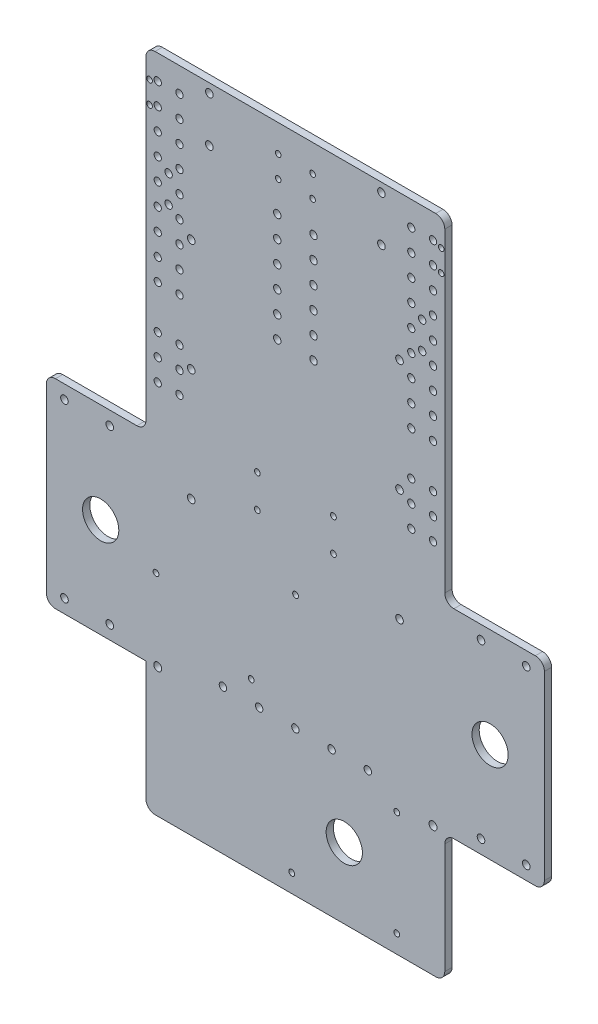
SolidWorks part; units mm, degrees
ref_plane "前视基准面" through (0, 0, 0) normal (0, 0, 1) x (1, 0, 0)
ref_plane "上视基准面" through (0, 0, 0) normal (0, 1, 0) x (1, 0, 0)
ref_plane "右视基准面" through (0, 0, 0) normal (1, 0, 0) x (0, 0, -1)
sketch "草图1" plane through (0, 0, 0) normal (0, 0, 1) x (1, 0, 0)
  line L0 (-50.9061, 33.4951) -> (-35.9061, 33.4951)
  line L1 (-50.9061, 103.4951) -> (79.0939, 103.4951)
  line L2 (-50.9061, 103.4951) -> (-50.9061, 33.4951)
  line L3 (-35.9061, -91.5049) -> (64.0939, -91.5049)
  line L4 (79.0939, 103.4951) -> (79.0939, 33.4951)
  line L5 (-35.9061, 33.4951) -> (-35.9061, -91.5049)
  line L6 (64.0939, -91.5049) -> (64.0939, 33.4951)
  line L7 (64.0939, 33.4951) -> (79.0939, 33.4951)
  dimension "D1" = 130
  dimension "D2" = 100
  dimension "D3" = 15
  dimension "D4" = 70
  dimension "D5" = 70
  dimension "D6" = 195
extrude "凸台-拉伸1" add sketch "草图1" along normal blind 4
sketch "草图2" plane through (0, 0, 4) normal (0, 0, 1) x (1, 0, 0)
  line L0 (79.0939, 103.4951) -> (-50.9061, 103.4951) construction
  line L1 (-40.9061, 103.4951) -> (69.0939, 103.4951)
  line L2 (-40.9061, 103.4951) -> (-40.9061, 123.4951)
  line L3 (-40.9061, 123.4951) -> (69.0939, 123.4951)
  line L4 (69.0939, 103.4951) -> (69.0939, 123.4951)
  line L5 (14.0939, -91.5049) -> (14.0939, 116.1376) construction
  line L6 (-35.9061, -91.5049) -> (64.0939, -91.5049) construction
  dimension "D1" = 55
  dimension "D2" = 55
  dimension "D3" = 20
extrude "凸台-拉伸2" add sketch "草图2" against normal up to surface (4 mm away)
sketch "草图3" plane through (0, 0, 4) normal (0, 0, 1) x (1, 0, 0)
  line L1 (-35.9061, 33.4951) -> (-95.9061, 33.4951)
  line L2 (-35.9061, 33.4951) -> (-35.9061, -116.5049)
  line L3 (-35.9061, -116.5049) -> (-95.9061, -116.5049)
  line L4 (-95.9061, 33.4951) -> (-95.9061, -116.5049)
  line L5 (64.0939, 33.4951) -> (124.0939, 33.4951)
  line L6 (64.0939, 33.4951) -> (64.0939, -116.5049)
  line L7 (64.0939, -116.5049) -> (124.0939, -116.5049)
  line L8 (124.0939, 33.4951) -> (124.0939, -116.5049)
  dimension "D1" = 60
  dimension "D2" = 150
  dimension "D3" = 150
  dimension "D4" = 60
extrude "凸台-拉伸3" add sketch "草图3" against normal up to surface (4 mm away)
sketch "草图4" plane through (0, 0, 4) normal (0, 0, 1) x (1, 0, 0)
  line L0 (-35.9061, -91.5049) -> (64.0939, -91.5049) construction
  line L1 (-35.9061, -91.5049) -> (64.0939, -91.5049)
  line L2 (-35.9061, -91.5049) -> (-35.9061, -261.5049)
  line L3 (-35.9061, -261.5049) -> (64.0939, -261.5049)
  line L4 (64.0939, -91.5049) -> (64.0939, -261.5049)
  dimension "D1" = 170
extrude "凸台-拉伸4" add sketch "草图4" against normal up to surface (4 mm away)
sketch "草图5" plane through (0, 0, 0) normal (0, 0, -1) x (-1, 0, 0)
  line L0 (-79.0939, 103.4951) -> (-69.0939, 103.4951) construction
  line L1 (-69.0939, 123.4951) -> (-69.0939, 103.4951) construction
  line L2 (-14.0939, 123.4951) -> (-14.0939, 75.6641) construction
  line L3 (40.9061, 123.4951) -> (-69.0939, 123.4951) construction
  circle A0 centre (-61.5939, 118.4951) radius 2.05
  circle A1 centre (-61.5939, 108.4951) radius 2.05
  circle A2 centre (33.4061, 108.4951) radius 2.05
  circle A3 centre (33.4061, 118.4951) radius 2.05
  dimension "D1" = 4.1
  dimension "D2" = 4.1
  dimension "D3" = 10
  dimension "D4" = 5
  dimension "D5" = 7.5
  dimension "D6" = 7.5
extrude "切除-拉伸1" cut sketch "草图5" against normal blind 10
sketch "草图6" plane through (0, 0, 0) normal (0, 0, -1) x (-1, 0, 0)
  line L0 (-14.0939, 123.4951) -> (-14.0939, -261.5049) construction
  line L1 (40.9061, 123.4951) -> (-69.0939, 123.4951) construction
  line L2 (-64.0939, -261.5049) -> (35.9061, -261.5049) construction
  line L4 (-39.0939, -166.5049) -> (10.9061, -166.5049) construction
  line L5 (-39.0939, -166.5049) -> (-39.0939, -216.5049) construction
  line L6 (-39.0939, -216.5049) -> (10.9061, -216.5049) construction
  line L7 (10.9061, -166.5049) -> (10.9061, -216.5049) construction
  circle A0 centre (10.9061, -166.5049) radius 1.5
  circle A1 centre (-39.0939, -166.5049) radius 1.5
  circle A2 centre (-39.0939, -216.5049) radius 1.5
  circle A3 centre (10.9061, -216.5049) radius 1.5
  dimension "D5" = 3
  dimension "D6" = 3
  dimension "D7" = 3
  dimension "D8" = 3
  dimension "D1" = 50
  dimension "D2" = 50
  dimension "D3" = 25
  dimension "D4" = 290
extrude "切除-拉伸2" cut sketch "草图6" against normal blind 10
sketch "草图7" plane through (0, 0, 0) normal (0, 0, -1) x (-1, 0, 0)
  line L0 (-64.0939, -116.5049) -> (-64.0939, -261.5049) construction
  line L1 (-124.0939, -116.5049) -> (-64.0939, -116.5049)
  line L2 (-124.0939, -116.5049) -> (-124.0939, -171.5049)
  line L3 (-124.0939, -171.5049) -> (-64.0939, -171.5049)
  line L4 (-64.0939, -116.5049) -> (-64.0939, -171.5049)
  line L5 (-14.0939, 123.4951) -> (-14.0939, -261.5049) construction
  line L6 (40.9061, 123.4951) -> (-69.0939, 123.4951) construction
  line L7 (-64.0939, -261.5049) -> (35.9061, -261.5049) construction
  line L8 (35.9061, -116.5049) -> (35.9061, -171.5049)
  line L9 (95.9061, -171.5049) -> (35.9061, -171.5049)
  line L10 (95.9061, -116.5049) -> (95.9061, -171.5049)
  line L11 (95.9061, -116.5049) -> (35.9061, -116.5049)
  dimension "D1" = 55
extrude "凸台-拉伸5" add sketch "草图7" against normal up to surface (4 mm away)
sketch "草图8" plane through (0, 0, 0) normal (0, 0, -1) x (-1, 0, 0)
  line L0 (-114.0939, -36.5049) -> (85.9061, -36.5049) construction
  line L1 (-124.0939, 33.4951) -> (-124.0939, -171.5049) construction
  line L3 (-14.0939, 123.4951) -> (-14.0939, -261.5049) construction
  line L4 (40.9061, 123.4951) -> (-69.0939, 123.4951) construction
  line L5 (-64.0939, -261.5049) -> (35.9061, -261.5049) construction
  circle A0 centre (-114.0939, 10.9951) radius 2
  circle A1 centre (-104.0939, 10.9951) radius 2
  circle A4 centre (-104.0939, -84.0049) radius 2
  circle A5 centre (-114.0939, -84.0049) radius 2
  circle A6 centre (85.9061, -84.0049) radius 2
  circle A7 centre (75.9061, -84.0049) radius 2
  circle A8 centre (75.9061, 10.9951) radius 2
  circle A9 centre (85.9061, 10.9951) radius 2
  dimension "D1" = 4
  dimension "D2" = 4
  dimension "D3" = 10
  dimension "D4" = 10
  dimension "D5" = 47.5
  dimension "D6" = 47.5
  dimension "D7" = 160
extrude "切除-拉伸3" cut sketch "草图8" against normal blind 10
sketch "草图9" plane through (0, 0, 0) normal (0, 0, -1) x (-1, 0, 0)
  line L0 (-14.0939, -261.5049) -> (-14.0939, -180.2572) construction
  line L1 (-64.0939, -261.5049) -> (35.9061, -261.5049) construction
  circle A0 centre (33.4061, -221.5049) radius 2
  circle A1 centre (33.4061, -231.5049) radius 2
  circle A2 centre (-61.5939, -231.5049) radius 2
  circle A3 centre (-61.5939, -221.5049) radius 2
  dimension "D1" = 4
  dimension "D2" = 4
  dimension "D3" = 10
  dimension "D4" = 30
  dimension "D5" = 47.5
  dimension "D6" = 47.5
extrude "切除-拉伸4" cut sketch "草图9" against normal blind 10
sketch "草图10" plane through (0, 0, 0) normal (0, 0, -1) x (-1, 0, 0)
  line L0 (-124.0939, -171.5049) -> (-64.0939, -171.5049) construction
  line L1 (-64.0939, -261.5049) -> (-69.0939, -261.5049)
  line L2 (-64.0939, -261.5049) -> (-64.0939, -171.5049)
  line L3 (-64.0939, -171.5049) -> (-69.0939, -171.5049)
  line L4 (-69.0939, -261.5049) -> (-69.0939, -171.5049)
  line L5 (-14.0939, -261.5049) -> (-14.0939, -148.6637) construction
  line L6 (-64.0939, -261.5049) -> (35.9061, -261.5049) construction
  line L7 (40.9061, -261.5049) -> (40.9061, -171.5049)
  line L8 (35.9061, -171.5049) -> (40.9061, -171.5049)
  line L9 (35.9061, -261.5049) -> (35.9061, -171.5049)
  line L10 (35.9061, -261.5049) -> (40.9061, -261.5049)
  circle A0 centre (-61.5939, -221.5049) radius 2 construction
  dimension "D1" = 7.5
extrude "凸台-拉伸6" add sketch "草图10" against normal up to surface (4 mm away)
sketch "草图11" plane through (0, 0, 0) normal (0, 0, -1) x (-1, 0, 0)
  line L1 (-69.0939, -261.5049) -> (40.9061, -261.5049)
  line L2 (-69.0939, -261.5049) -> (-69.0939, -266.5049)
  line L3 (-69.0939, -266.5049) -> (40.9061, -266.5049)
  line L4 (40.9061, -261.5049) -> (40.9061, -266.5049)
  dimension "D1" = 5
extrude "凸台-拉伸7" add sketch "草图11" against normal up to surface (4 mm away)
sketch "草图12" plane through (0, 0, 0) normal (0, 0, -1) x (-1, 0, 0)
  line L0 (-79.0939, 68.4951) -> (50.9061, 68.4951) construction
  line L1 (-79.0939, 33.4951) -> (-79.0939, 103.4951) construction
  line L2 (50.9061, 103.4951) -> (50.9061, 33.4951) construction
  line L3 (-14.0939, 123.4951) -> (-14.0939, -31.782) construction
  line L4 (40.9061, 123.4951) -> (-69.0939, 123.4951) construction
  line L5 (-14.0939, 68.4951) -> (-60.2666, -58.3634) construction
  line L6 (-14.0939, 68.4951) -> (10.2169, -69.3779) construction
  line L7 (-40.2666, -103.3634) -> (-80.2666, -103.3634) construction
  line L8 (-40.2666, -103.3634) -> (-40.2666, -13.3634) construction
  line L9 (-40.2666, -13.3634) -> (-80.2666, -13.3634) construction
  line L10 (-80.2666, -103.3634) -> (-80.2666, -13.3634) construction
  line L11 (-40.2666, -103.3634) -> (-80.2666, -13.3634) construction
  line L12 (-40.2666, -13.3634) -> (-80.2666, -103.3634) construction
  circle A0 centre (-14.0939, 68.4951) radius 97.5 construction
  circle A1 centre (-40.2666, -13.3634) radius 2
  circle A2 centre (-40.2666, -103.3634) radius 2
  circle A3 centre (-80.2666, -103.3634) radius 2
  circle A4 centre (-80.2666, -13.3634) radius 2
  circle A5 centre (-14.0939, 68.4951) radius 140 construction
  circle A6 centre (32.0591, -63.6786) radius 10 construction
  dimension "D1" = 195
  dimension "D3" = 90
  dimension "D4" = 135
  dimension "D5" = 40
  dimension "D6" = 4
  dimension "D7" = 4
  dimension "D8" = 4
  dimension "D9" = 4
  dimension "D11" = 20
  dimension "D13" = 22.5
  dimension "D2" = 20
  dimension "D10" = 140
  dimension "D12" = 10
extrude "切除-拉伸6" cut sketch "草图12" against normal blind 10
sketch "草图14" plane through (0, 0, 0) normal (0, 0, -1) x (-1, 0, 0)
  line L0 (-14.0939, 123.4951) -> (-14.0939, -266.5049) construction
  line L1 (-124.0939, 33.4951) -> (-100.0939, 33.4951)
  line L2 (-124.0939, 33.4951) -> (-124.0939, 18.4951)
  line L3 (-124.0939, 18.4951) -> (-100.0939, 18.4951)
  line L4 (-100.0939, 33.4951) -> (-100.0939, 18.4951)
  line L5 (-124.0939, -171.5049) -> (-100.0939, -171.5049)
  line L6 (-124.0939, -171.5049) -> (-124.0939, -91.5049)
  line L7 (-124.0939, -91.5049) -> (-100.0939, -91.5049)
  line L8 (-100.0939, -171.5049) -> (-100.0939, -91.5049)
  line L9 (40.9061, 123.4951) -> (-69.0939, 123.4951) construction
  line L10 (-69.0939, -266.5049) -> (40.9061, -266.5049) construction
  line L11 (71.9061, -171.5049) -> (71.9061, -91.5049)
  line L12 (95.9061, -91.5049) -> (71.9061, -91.5049)
  line L13 (95.9061, -171.5049) -> (95.9061, -91.5049)
  line L14 (95.9061, -171.5049) -> (71.9061, -171.5049)
  line L15 (71.9061, 33.4951) -> (71.9061, 18.4951)
  line L16 (95.9061, 18.4951) -> (71.9061, 18.4951)
  line L17 (95.9061, 33.4951) -> (95.9061, 18.4951)
  line L18 (95.9061, 33.4951) -> (71.9061, 33.4951)
  dimension "D1" = 24
  dimension "D2" = 24
  dimension "D3" = 15
  dimension "D4" = 80
extrude "切除-拉伸7" cut sketch "草图14" against normal blind 8
sketch "草图15" plane through (0, 0, 0) normal (0, 0, -1) x (-1, 0, 0)
  circle A0 centre (-80.2666, -33.3634) radius 2
  circle A1 centre (-40.2666, -33.3634) radius 2
  circle A2 centre (-80.2666, -83.3634) radius 2
  circle A3 centre (-40.2666, -83.3634) radius 2
  circle A4 centre (-80.2666, -13.3634) radius 2 construction
  circle A5 centre (-40.2666, -13.3634) radius 2 construction
  circle A6 centre (-40.2666, -103.3634) radius 2 construction
  circle A7 centre (-80.2666, -103.3634) radius 2 construction
  dimension "D1" = 4
  dimension "D2" = 4
  dimension "D3" = 4
  dimension "D4" = 4
  dimension "D5" = 20
  dimension "D6" = 20
  dimension "D7" = 20
  dimension "D8" = 20
extrude "切除-拉伸8" cut sketch "草图15" against normal blind 8
sketch "草图16" plane through (0, 0, 0) normal (0, 0, -1) x (-1, 0, 0)
  line L1 (40.9061, 103.4951) -> (40.9061, 123.4951) construction
  line L2 (-69.0939, 123.4951) -> (40.9061, 123.4951)
  line L3 (-69.0939, 123.4951) -> (-69.0939, 153.4951)
  line L4 (-69.0939, 153.4951) -> (40.9061, 153.4951)
  line L5 (40.9061, 123.4951) -> (40.9061, 153.4951)
  dimension "D1" = 30
extrude "凸台-拉伸8" add sketch "草图16" against normal up to surface (4 mm away)
sketch "草图18" plane through (0, 0, 0) normal (0, 0, -1) x (-1, 0, 0)
  line L0 (40.9061, -266.5049) -> (40.9061, -171.5049) construction
  line L1 (-69.0939, -266.5049) -> (40.9061, -266.5049)
  line L2 (-69.0939, -266.5049) -> (-69.0939, -261.5049)
  line L3 (-69.0939, -261.5049) -> (40.9061, -261.5049)
  line L4 (40.9061, -266.5049) -> (40.9061, -261.5049)
  dimension "D1" = 5
extrude "切除-拉伸11" cut sketch "草图18" against normal blind 10
sketch "草图19" plane through (0, 0, 0) normal (0, 0, -1) x (-1, 0, 0)
  line L1 (-100.0939, 33.4951) -> (-96.5939, 33.4951)
  line L2 (-100.0939, 33.4951) -> (-100.0939, 18.4951)
  line L3 (-100.0939, 18.4951) -> (-96.5939, 18.4951)
  line L4 (-96.5939, 33.4951) -> (-96.5939, 18.4951)
  line L5 (71.9061, 33.4951) -> (68.4061, 33.4951)
  line L6 (71.9061, 33.4951) -> (71.9061, 18.4951)
  line L7 (71.9061, 18.4951) -> (68.4061, 18.4951)
  line L8 (68.4061, 33.4951) -> (68.4061, 18.4951)
  line L9 (71.9061, -171.5049) -> (68.4061, -171.5049)
  line L10 (71.9061, -171.5049) -> (71.9061, -91.5049)
  line L11 (71.9061, -91.5049) -> (68.4061, -91.5049)
  line L12 (68.4061, -171.5049) -> (68.4061, -91.5049)
  line L13 (-100.0939, -171.5049) -> (-96.5939, -171.5049)
  line L14 (-100.0939, -171.5049) -> (-100.0939, -91.5049)
  line L15 (-100.0939, -91.5049) -> (-96.5939, -91.5049)
  line L16 (-96.5939, -171.5049) -> (-96.5939, -91.5049)
  dimension "D1" = 3.5
  dimension "D2" = 3.5
  dimension "D3" = 3.5
  dimension "D4" = 3.5
extrude "切除-拉伸12" cut sketch "草图19" against normal blind 10
sketch "草图20" plane through (0, 0, 0) normal (0, 0, -1) x (-1, 0, 0)
  line L1 (-96.5939, 33.4951) -> (-69.0939, 33.4951)
  line L2 (-96.5939, 33.4951) -> (-96.5939, 153.4951)
  line L3 (-96.5939, 153.4951) -> (-69.0939, 153.4951)
  line L4 (-69.0939, 33.4951) -> (-69.0939, 153.4951)
  line L5 (68.4061, 33.4951) -> (40.9061, 33.4951)
  line L6 (68.4061, 33.4951) -> (68.4061, 153.4951)
  line L7 (68.4061, 153.4951) -> (40.9061, 153.4951)
  line L8 (40.9061, 33.4951) -> (40.9061, 153.4951)
  line L9 (-96.5939, -171.5049) -> (-69.0939, -171.5049)
  line L10 (-96.5939, -171.5049) -> (-96.5939, -261.5049)
  line L11 (-96.5939, -261.5049) -> (-69.0939, -261.5049)
  line L12 (-69.0939, -171.5049) -> (-69.0939, -261.5049)
  line L13 (68.4061, -171.5049) -> (40.9061, -171.5049)
  line L14 (68.4061, -171.5049) -> (68.4061, -261.5049)
  line L15 (68.4061, -261.5049) -> (40.9061, -261.5049)
  line L16 (40.9061, -171.5049) -> (40.9061, -261.5049)
extrude "凸台-拉伸9" add sketch "草图20" against normal up to surface (4 mm away)
sketch "草图21" plane through (0, 0, 0) normal (0, 0, -1) x (-1, 0, 0)
  line L1 (68.4061, 153.4951) -> (-96.5939, 153.4951) construction
  line L2 (-14.0939, 153.4951) -> (-14.0939, 74.4578) construction
  circle A4 centre (-78.0939, 84.9951) radius 2
  circle A5 centre (-90.0939, 84.9951) radius 2
  circle A6 centre (49.9061, 84.9951) radius 2
  circle A7 centre (61.9061, 84.9951) radius 2
  circle A8 centre (-78.0939, 72.9951) radius 2
  circle A9 centre (-90.0939, 72.9951) radius 2
  circle A10 centre (49.9061, 72.9951) radius 2
  circle A11 centre (61.9061, 72.9951) radius 2
  circle A12 centre (-78.0939, 60.9951) radius 2
  circle A13 centre (-90.0939, 60.9951) radius 2
  circle A14 centre (49.9061, 60.9951) radius 2
  circle A15 centre (61.9061, 60.9951) radius 2
  circle A16 centre (-78.0939, 48.9951) radius 2
  circle A17 centre (-90.0939, 48.9951) radius 2
  circle A18 centre (49.9061, 48.9951) radius 2
  circle A19 centre (61.9061, 48.9951) radius 2
  circle A24 centre (-78.0939, 24.9951) radius 2
  circle A25 centre (-90.0939, 24.9951) radius 2
  circle A26 centre (49.9061, 24.9951) radius 2
  circle A27 centre (61.9061, 24.9951) radius 2
  circle A28 centre (-78.0939, 12.9951) radius 2
  circle A29 centre (-90.0939, 12.9951) radius 2
  circle A30 centre (49.9061, 12.9951) radius 2
  circle A31 centre (61.9061, 12.9951) radius 2
  circle A32 centre (-78.0939, 0.9951) radius 2
  circle A33 centre (-90.0939, 0.9951) radius 2
  circle A34 centre (49.9061, 0.9951) radius 2
  circle A35 centre (61.9061, 0.9951) radius 2
extrude "切除-拉伸13" cut sketch "草图21" against normal blind 10
sketch "草图22" plane through (0, 0, 0) normal (0, 0, -1) x (-1, 0, 0)
  line L0 (-96.5939, -261.5049) -> (-96.5939, -91.5049) construction
  line L1 (68.4061, -261.5049) -> (-96.5939, -261.5049) construction
  line L2 (-14.0939, -261.5049) -> (-14.0939, -180.4875) construction
  circle A0 centre (-90.0939, -257.0049) radius 2.05
  circle A1 centre (-102.0939, -257.0049) radius 2.05
  circle A2 centre (73.9061, -257.0049) radius 2.05
  circle A3 centre (61.9061, -257.0049) radius 2.05
  dimension "D1" = 4.1
  dimension "D2" = 4.1
  dimension "D3" = 12
  dimension "D4" = 6.5
  dimension "D5" = 4.5
extrude "切除-拉伸14" cut sketch "草图22" against normal blind 10
sketch "草图23" plane through (0, 0, 0) normal (0, 0, -1) x (-1, 0, 0)
  line L0 (68.4061, 153.4951) -> (68.4061, 18.4951) construction
  line L2 (68.4061, 106.4951) -> (52.4061, 106.4951)
  line L3 (68.4061, 106.4951) -> (68.4061, 114.4951)
  line L4 (68.4061, 114.4951) -> (52.4061, 114.4951)
  line L5 (52.4061, 106.4951) -> (52.4061, 114.4951)
  line L6 (-80.5939, 106.4951) -> (-80.5939, 114.4951)
  line L12 (-14.0939, -261.5049) -> (-14.0939, 153.4952) construction
  line L18 (-96.5939, 114.4951) -> (-80.5939, 114.4951)
  line L19 (-96.5939, 106.4951) -> (-96.5939, 114.4951)
  line L20 (-96.5939, 106.4951) -> (-80.5939, 106.4951)
  dimension "D1" = 16
  dimension "D2" = 8
  dimension "D4" = 82.5
extrude "切除-拉伸15" cut sketch "草图23" against normal blind 25
sketch "草图26" plane through (0, 0, 0) normal (0, 0, -1) x (-1, 0, 0)
  line L1 (-96.5939, 106.4951) -> (104.8211, 106.4951)
  line L2 (-96.5939, 106.4951) -> (-96.5939, 194.4886)
  line L3 (-96.5939, 194.4886) -> (104.8211, 194.4886)
  line L4 (104.8211, 106.4951) -> (104.8211, 194.4886)
extrude "切除-拉伸20" cut sketch "草图26" against normal blind 10
sketch "草图27" plane through (0, 0, 0) normal (0, 0, -1) x (-1, 0, 0)
  line L0 (-96.5939, 106.4951) -> (-62.0439, 106.4951) construction
  line L1 (-96.5939, 106.4951) -> (68.4061, 106.4951)
  line L2 (-96.5939, 106.4951) -> (-96.5939, 111.4951)
  line L3 (-96.5939, 111.4951) -> (68.4061, 111.4951)
  line L4 (68.4061, 106.4951) -> (68.4061, 111.4951)
  dimension "D1" = 5
extrude "凸台-拉伸10" add sketch "草图27" against normal up to surface (4 mm away)
sketch "草图28" plane through (0, 0, 0) normal (0, 0, -1) x (-1, 0, 0)
  line L0 (68.4061, -91.5049) -> (68.4061, -261.5049) construction
  line L1 (-96.5939, -261.5049) -> (68.4061, -261.5049)
  line L2 (-96.5939, -261.5049) -> (-96.5939, -141.5049)
  line L3 (-96.5939, -141.5049) -> (68.4061, -141.5049)
  line L4 (68.4061, -261.5049) -> (68.4061, -141.5049)
  dimension "D1" = 120
extrude "切除-拉伸21" cut sketch "草图28" against normal blind 10
sketch "草图34" plane through (0, 0, 0) normal (0, 0, -1) x (-1, 0, 0)
  line L1 (-96.5939, 111.4951) -> (68.4061, 111.4951)
  line L2 (-96.5939, 111.4951) -> (-96.5939, 121.4951)
  line L3 (-96.5939, 121.4951) -> (68.4061, 121.4951)
  line L4 (68.4061, 111.4951) -> (68.4061, 121.4951)
  dimension "D1" = 10
extrude "凸台-拉伸11" add sketch "草图34" against normal up to surface (4 mm away)
sketch "草图35" plane through (0, 0, 0) normal (0, 0, -1) x (-1, 0, 0)
  line L0 (-14.0939, 121.4951) -> (-14.0939, 68.3284) construction
  line L1 (68.4061, 121.4951) -> (-96.5939, 121.4951) construction
  circle A0 centre (33.4061, 118.4951) radius 2.05
  circle A1 centre (33.4061, 108.4951) radius 2.05 construction
  circle A2 centre (-61.5939, 118.4951) radius 2.05
  dimension "D1" = 4.1
  dimension "D2" = 10
  dimension "D5" = 47.5
extrude "切除-拉伸22" cut sketch "草图35" against normal blind 10
sketch "草图37" plane through (0, 0, 4) normal (0, 0, 1) x (1, 0, 0)
  line L0 (14.0939, 121.4951) -> (14.0939, 53.4054) construction
  line L1 (-68.4061, 121.4951) -> (96.5939, 121.4951) construction
  circle A0 centre (4.0939, 114.4951) radius 2.05
  circle A1 centre (24.0939, 114.4951) radius 2.05
  circle A2 centre (4.0939, 102.4951) radius 2.05
  circle A3 centre (24.0939, 102.4951) radius 2.05
  circle A4 centre (4.0939, 90.4951) radius 2.05
  circle A5 centre (24.0939, 90.4951) radius 2.05
  dimension "D1" = 4.1
  dimension "D2" = 10
  dimension "D3" = 7
  dimension "D4" = 3
extrude "切除-拉伸24" cut sketch "草图37" against normal blind 10
sketch "草图40" plane through (0, 0, 4) normal (0, 0, 1) x (1, 0, 0)
  line L0 (14.0939, 121.4951) -> (14.0939, 45.5838) construction
  line L1 (-68.4061, 121.4951) -> (96.5939, 121.4951) construction
  line L2 (96.5939, 121.4951) -> (96.5939, 18.4951) construction
  circle A0 centre (53.7439, 98.4951) radius 2.05
  circle A1 centre (73.7439, 98.4951) radius 2.05
  circle A2 centre (73.7439, 38.4951) radius 2.05
  circle A3 centre (53.7439, 38.4951) radius 2.05
  circle A4 centre (-25.5561, 38.4951) radius 2.05
  circle A5 centre (-45.5561, 38.4951) radius 2.05
  circle A6 centre (-45.5561, 98.4951) radius 2.05
  circle A7 centre (-25.5561, 98.4951) radius 2.05
  dimension "D1" = 22.85
  dimension "D2" = 22.85
  dimension "D3" = 20
  dimension "D4" = 20
  dimension "D5" = 60
  dimension "D6" = 23
  dimension "D7" = 4.1
  dimension "D8" = 4.1
  dimension "D9" = 4.1
  dimension "D10" = 4.1
  dimension "D11" = 23
  dimension "D12" = 60
extrude "切除-拉伸25" cut sketch "草图40" against normal blind 10
sketch "草图43" plane through (0, 0, 0) normal (0, 0, -1) x (-1, 0, 0)
  line L1 (-96.5939, 121.4951) -> (68.4061, 121.4951)
  line L2 (-96.5939, 121.4951) -> (-96.5939, 136.4951)
  line L3 (-96.5939, 136.4951) -> (68.4061, 136.4951)
  line L4 (68.4061, 121.4951) -> (68.4061, 136.4951)
  dimension "D1" = 15
extrude "凸台-拉伸12" add sketch "草图43" against normal up to surface (4 mm away)
sketch "草图44" plane through (0, 0, 4) normal (0, 0, 1) x (1, 0, 0)
  line L0 (-68.4061, -141.5049) -> (-68.4061, -91.5049) construction
  line L1 (96.5939, -141.5049) -> (-68.4061, -141.5049) construction
  line L2 (14.0939, -141.5049) -> (14.0939, -50.0935) construction
  circle A0 centre (-61.9061, -135.0049) radius 2.2
  circle A1 centre (-73.9061, -135.0049) radius 2.05
  circle A10 centre (102.0939, -135.0049) radius 2.05
  circle A11 centre (90.0939, -135.0049) radius 2.2
  dimension "D1" = 4.4
  dimension "D2" = 4.1
  dimension "D3" = 12
  dimension "D4" = 6.5
  dimension "D5" = 6.5
extrude "切除-拉伸26" cut sketch "草图44" against normal blind 10
sketch "草图45" plane through (0, 0, 0) normal (0, 0, -1) x (-1, 0, 0)
  line L0 (-14.0939, -141.5049) -> (-14.0939, 24.3299) construction
  line L1 (68.4061, -141.5049) -> (-96.5939, -141.5049) construction
  circle A0 centre (5.9061, -126.5049) radius 2.05
  circle A1 centre (-34.0939, -126.5049) radius 2.05
  circle A2 centre (-54.0939, -126.5049) radius 2.05
  circle A3 centre (25.9061, -126.5049) radius 2.05
  circle A4 centre (-14.0939, -126.5049) radius 2.05
  dimension "D1" = 4.1
  dimension "D2" = 4.1
  dimension "D3" = 20
  dimension "D4" = 20
  dimension "D5" = 15
  dimension "D6" = 15
  dimension "D7" = 20
  dimension "D8" = 20
  dimension "D9" = 4.1
  dimension "D10" = 4.1
  dimension "D11" = 4.1
extrude "切除-拉伸27" cut sketch "草图45" against normal blind 10
fillet "圆角1" radius 5 8 edges at (-68.4061, -141.5049, 2) (96.5939, -141.5049, 2) (96.5939, 136.4951, 2) (-68.4061, 136.4951, 2) (-95.9061, -91.5049, 2) (-95.9061, 18.4951, 2) (124.0939, 18.4951, 2) (124.0939, -91.5049, 2)
fillet "圆角2" radius 5 4 edges at (96.5939, -91.5049, 2) (-68.4061, -91.5049, 2) (-68.4061, 18.4951, 2) (96.5939, 18.4951, 2)
sketch "草图46" plane through (0, 0, 0) normal (0, 0, -1) x (-1, 0, 0)
  circle A1 centre (62.866, -90.6303) radius 1.6
  circle A3 centre (10.3002, -115.1422) radius 1.6
  circle A5 centre (-14.2117, -62.5763) radius 1.6
extrude "切除-拉伸28" cut sketch "草图46" against normal blind 10
sketch "草图47" plane through (0, 0, 0) normal (0, 0, -1) x (-1, 0, 0)
  line L0 (-14.0939, 136.4951) -> (-14.0939, -141.5049) construction
  line L1 (63.4061, 136.4951) -> (-91.5939, 136.4951) construction
  line L2 (-91.5939, -141.5049) -> (63.4061, -141.5049) construction
  circle A0 centre (-71.5939, 78.4951) radius 2.1
  circle A1 centre (43.4061, 78.4951) radius 2.1
  circle A2 centre (43.4061, 16.4951) radius 2.1
  circle A3 centre (-71.5939, 16.4951) radius 2.1
  circle A4 centre (43.4061, -45.5049) radius 2.1
  circle A5 centre (-71.5939, -45.5049) radius 2.1
  dimension "D2" = 115
  dimension "D1" = 4.2
  dimension "D3" = 58
  dimension "D4" = 3
extrude "切除-拉伸29" cut sketch "草图47" against normal blind 10
sketch "草图50" plane through (0, 0, 0) normal (0, 0, -1) x (-1, 0, 0)
  line L0 (-14.0939, 136.4951) -> (-14.0939, -141.5049) construction
  line L1 (63.4061, 136.4951) -> (-91.5939, 136.4951) construction
  line L2 (63.4061, -141.5049) -> (-91.5939, -141.5049) construction
  circle A0 centre (-61.5939, 118.4951) radius 2.1
  circle A1 centre (-61.5939, 108.4951) radius 2.1
  circle A2 centre (33.4061, 108.4951) radius 2.1
  circle A3 centre (33.4061, 118.4951) radius 2.1
  circle A4 centre (-61.5939, 118.4951) radius 2.05 construction
  dimension "D1" = 4.2
  dimension "D2" = 10
  dimension "D3" = 95
  dimension "D4" = 0
extrude "切除-拉伸30" cut sketch "草图50" against normal blind 10
sketch "草图51" plane through (0, 0, 0) normal (0, 0, -1) x (-1, 0, 0)
  circle A0 centre (-40.2666, -103.3634) radius 2 construction
  circle A1 centre (-80.2666, -103.3634) radius 2 construction
  circle A2 centre (-40.2666, -83.3634) radius 2 construction
  circle A3 centre (-80.2666, -83.3634) radius 2 construction
  circle A4 centre (-40.2666, -33.3634) radius 2 construction
  circle A5 centre (-80.2666, -33.3634) radius 2 construction
  circle A6 centre (-40.2666, -13.3634) radius 2 construction
  circle A7 centre (-80.2666, -13.3634) radius 2 construction
  circle A8 centre (45.5561, 38.4951) radius 2.05 construction
  circle A9 centre (25.5561, 38.4951) radius 2.05 construction
  circle A10 centre (-73.7439, 38.4951) radius 2.05 construction
  circle A11 centre (-53.7439, 38.4951) radius 2.05 construction
  circle A12 centre (45.5561, 98.4951) radius 2.05 construction
  circle A13 centre (25.5561, 98.4951) radius 2.05 construction
  circle A14 centre (-53.7439, 98.4951) radius 2.05 construction
  circle A15 centre (-73.7439, 98.4951) radius 2.05 construction
  circle A16 centre (-40.2666, -103.3634) radius 2
  circle A17 centre (-80.2666, -103.3634) radius 2
  circle A18 centre (-40.2666, -83.3634) radius 2
  circle A19 centre (-80.2666, -83.3634) radius 2
  circle A20 centre (-40.2666, -33.3634) radius 2
  circle A21 centre (-80.2666, -33.3634) radius 2
  circle A22 centre (-40.2666, -13.3634) radius 2
  circle A23 centre (-80.2666, -13.3634) radius 2
  circle A24 centre (45.5561, 38.4951) radius 2.05
  circle A25 centre (25.5561, 38.4951) radius 2.05
  circle A26 centre (-73.7439, 38.4951) radius 2.05
  circle A27 centre (-53.7439, 38.4951) radius 2.05
  circle A28 centre (45.5561, 98.4951) radius 2.05
  circle A29 centre (25.5561, 98.4951) radius 2.05
  circle A30 centre (-53.7439, 98.4951) radius 2.05
  circle A31 centre (-73.7439, 98.4951) radius 2.05
extrude "凸台-拉伸14" add sketch "草图51" against normal up to surface (4 mm away)
sketch "草图53" plane through (0, 0, 0) normal (0, 0, -1) x (-1, 0, 0)
  line L0 (63.4061, -141.5049) -> (-91.5939, -141.5049) construction
  line L1 (63.4061, -141.5049) -> (-91.5939, -141.5049)
  line L2 (-96.5939, -136.5049) -> (-96.5939, -196.5049)
  line L3 (-96.5939, -196.5049) -> (68.4061, -196.5049)
  line L4 (68.4061, -196.5049) -> (68.4061, -136.5049)
  arc A0 (63.4061, -141.5049) -> (68.4061, -136.5049) centre (63.4061, -136.5049) ccw construction
  arc A1 (-96.5939, -136.5049) -> (-91.5939, -141.5049) centre (-91.5939, -136.5049) ccw construction
  arc A2 (63.4061, -141.5049) -> (68.4061, -136.5049) centre (63.4061, -136.5049) ccw
  arc A3 (-96.5939, -136.5049) -> (-91.5939, -141.5049) centre (-91.5939, -136.5049) ccw
  dimension "D1" = 55
extrude "凸台-拉伸15" add sketch "草图53" against normal up to surface (4 mm away)
sketch "草图54" plane through (0, 0, 4) normal (0, 0, 1) x (1, 0, 0)
  line L0 (-95.9061, 13.4951) -> (-95.9061, -86.5049) construction
  line L1 (-95.9061, 13.4951) -> (-95.9061, -86.5049)
  line L2 (-90.9061, 18.4951) -> (-115.9061, 18.4951)
  line L3 (-115.9061, 18.4951) -> (-115.9061, -91.5049)
  line L4 (-115.9061, -91.5049) -> (-90.9061, -91.5049)
  line L5 (14.0939, 136.4951) -> (14.0939, -196.5049) construction
  line L6 (-63.4061, 136.4951) -> (91.5939, 136.4951) construction
  line L7 (96.5939, -196.5049) -> (-68.4061, -196.5049) construction
  line L8 (144.0939, -91.5049) -> (119.0939, -91.5049)
  line L9 (144.0939, 18.4951) -> (144.0939, -91.5049)
  line L10 (119.0939, 18.4951) -> (144.0939, 18.4951)
  line L11 (124.0939, 13.4951) -> (124.0939, -86.5049)
  arc A0 (-95.9061, -86.5049) -> (-90.9061, -91.5049) centre (-90.9061, -86.5049) ccw construction
  arc A1 (-90.9061, 18.4951) -> (-95.9061, 13.4951) centre (-90.9061, 13.4951) ccw construction
  arc A2 (-95.9061, -86.5049) -> (-90.9061, -91.5049) centre (-90.9061, -86.5049) ccw
  arc A3 (-90.9061, 18.4951) -> (-95.9061, 13.4951) centre (-90.9061, 13.4951) ccw
  arc A4 (119.0939, 18.4951) -> (124.0939, 13.4951) centre (119.0939, 13.4951) cw
  arc A5 (124.0939, -86.5049) -> (119.0939, -91.5049) centre (119.0939, -86.5049) cw
  dimension "D1" = 20
extrude "凸台-拉伸16" add sketch "草图54" against normal up to surface (4 mm away)
sketch "草图56" plane through (0, 0, 0) normal (0, 0, -1) x (-1, 0, 0)
  circle A0 centre (55.9061, 88.9951) radius 2.05 construction
  circle A1 centre (55.9061, 103.9951) radius 2.05 construction
  circle A2 centre (-84.0939, 88.9951) radius 2.05 construction
  circle A3 centre (-84.0939, 103.9951) radius 2.05 construction
  circle A4 centre (55.9061, 88.9951) radius 2.05
  circle A5 centre (55.9061, 103.9951) radius 2.05
  circle A6 centre (-84.0939, 88.9951) radius 2.05
  circle A7 centre (-84.0939, 103.9951) radius 2.05
extrude "切除-拉伸33" cut sketch "草图56" against normal blind 10
sketch "草图57" plane through (0, 0, 4) normal (0, 0, 1) x (1, 0, 0)
  line L0 (96.5939, 131.4951) -> (96.5939, 23.4951) construction
  line L1 (-68.4061, 131.4951) -> (96.5939, 131.4951)
  line L2 (-68.4061, 131.4951) -> (-68.4061, 156.4951)
  line L3 (-68.4061, 156.4951) -> (96.5939, 156.4951)
  line L4 (96.5939, 131.4951) -> (96.5939, 156.4951)
  line L5 (-63.4061, 136.4951) -> (91.5939, 136.4951) construction
  dimension "D1" = 0
  dimension "D2" = 20
extrude "凸台-拉伸17" add sketch "草图57" against normal up to surface (4 mm away)
sketch "草图58" plane through (0, 0, 4) normal (0, 0, 1) x (1, 0, 0)
  circle A0 centre (61.5939, 118.4951) radius 2.1 construction
  circle A1 centre (61.5939, 108.4951) radius 2.1 construction
  circle A2 centre (-33.4061, 108.4951) radius 2.1 construction
  circle A3 centre (-33.4061, 118.4951) radius 2.1 construction
  circle A4 centre (61.5939, 118.4951) radius 2.1
  circle A5 centre (61.5939, 108.4951) radius 2.1
  circle A6 centre (-33.4061, 108.4951) radius 2.1
  circle A7 centre (-33.4061, 118.4951) radius 2.1
  circle A8 centre (61.5939, 133.4951) radius 2.1
  circle A9 centre (61.5939, 123.4951) radius 2.1
  circle A10 centre (-33.4061, 123.4951) radius 2.1
  circle A11 centre (-33.4061, 133.4951) radius 2.1
  dimension "D1" = 2
extrude "切除-拉伸34" cut sketch "草图58" against normal blind 10
sketch "草图59" plane through (0, 0, 0) normal (0, 0, -1) x (-1, 0, 0)
  circle A16 centre (61.9061, 84.9951) radius 2 construction
  circle A17 centre (49.9061, 84.9951) radius 2 construction
  circle A18 centre (-78.0939, 84.9951) radius 2 construction
  circle A19 centre (-90.0939, 84.9951) radius 2 construction
  circle A20 centre (61.9061, 84.9951) radius 2
  circle A21 centre (49.9061, 84.9951) radius 2
  circle A22 centre (-78.0939, 84.9951) radius 2
  circle A23 centre (-90.0939, 84.9951) radius 2
  circle A24 centre (61.9061, 96.9951) radius 2
  circle A25 centre (49.9061, 96.9951) radius 2
  circle A26 centre (-78.0939, 96.9951) radius 2
  circle A27 centre (-90.0939, 96.9951) radius 2
  circle A28 centre (61.9061, 108.9951) radius 2
  circle A29 centre (49.9061, 108.9951) radius 2
  circle A30 centre (-78.0939, 108.9951) radius 2
  circle A31 centre (-90.0939, 108.9951) radius 2
  circle A32 centre (61.9061, 120.9951) radius 2
  circle A33 centre (49.9061, 120.9951) radius 2
  circle A34 centre (-78.0939, 120.9951) radius 2
  circle A35 centre (-90.0939, 120.9951) radius 2
  circle A36 centre (61.9061, 132.9951) radius 2
  circle A37 centre (49.9061, 132.9951) radius 2
  circle A38 centre (-78.0939, 132.9951) radius 2
  circle A39 centre (-90.0939, 132.9951) radius 2
  circle A40 centre (61.9061, 144.9951) radius 2
  circle A41 centre (49.9061, 144.9951) radius 2
  circle A42 centre (-78.0939, 144.9951) radius 2
  circle A43 centre (-90.0939, 144.9951) radius 2
extrude "切除-拉伸35" cut sketch "草图59" against normal blind 10
fillet "圆角3" radius 5 8 edges at (96.5939, 156.4951, 2) (-68.4061, 156.4951, 2) (-115.9061, 18.4951, 2) (-115.9061, -91.5049, 2) (-68.4061, -196.5049, 2) (96.5939, -196.5049, 2) (144.0939, -91.5049, 2) (144.0939, 18.4951, 2)
sketch "草图61" plane through (0, 0, 0) normal (0, 0, -1) x (-1, 0, 0)
  circle A0 centre (85.9061, -84.0049) radius 2 construction
  circle A1 centre (75.9061, -84.0049) radius 2 construction
  circle A2 centre (85.9061, 10.9951) radius 2 construction
  circle A3 centre (75.9061, 10.9951) radius 2 construction
  circle A4 centre (-104.0939, -84.0049) radius 2 construction
  circle A5 centre (-114.0939, -84.0049) radius 2 construction
  circle A6 centre (-104.0939, 10.9951) radius 2 construction
  circle A7 centre (-114.0939, 10.9951) radius 2 construction
  circle A8 centre (85.9061, -84.0049) radius 2
  circle A9 centre (75.9061, -84.0049) radius 2
  circle A10 centre (85.9061, 10.9951) radius 2
  circle A11 centre (75.9061, 10.9951) radius 2
  circle A12 centre (-104.0939, -84.0049) radius 2
  circle A13 centre (-114.0939, -84.0049) radius 2
  circle A14 centre (-104.0939, 10.9951) radius 2
  circle A15 centre (-114.0939, 10.9951) radius 2
  circle A16 centre (33.4061, 133.4951) radius 2.1 construction
  circle A17 centre (33.4061, 123.4951) radius 2.1 construction
  circle A18 centre (33.4061, 118.4951) radius 2.1 construction
  circle A19 centre (33.4061, 108.4951) radius 2.1 construction
  circle A20 centre (-61.5939, 108.4951) radius 2.1 construction
  circle A21 centre (-61.5939, 118.4951) radius 2.1 construction
  circle A22 centre (-61.5939, 123.4951) radius 2.1 construction
  circle A23 centre (-61.5939, 133.4951) radius 2.1 construction
  circle A24 centre (33.4061, 133.4951) radius 2.1
  circle A25 centre (33.4061, 123.4951) radius 2.1
  circle A26 centre (33.4061, 118.4951) radius 2.1
  circle A27 centre (33.4061, 108.4951) radius 2.1
  circle A28 centre (-61.5939, 108.4951) radius 2.1
  circle A29 centre (-61.5939, 118.4951) radius 2.1
  circle A30 centre (-61.5939, 123.4951) radius 2.1
  circle A31 centre (-61.5939, 133.4951) radius 2.1
extrude "凸台-拉伸18" add sketch "草图61" against normal blind 4
sketch "草图62" plane through (0, 0, 0) normal (0, 0, -1) x (-1, 0, 0)
  line L0 (-14.0939, 156.4951) -> (-14.0939, -196.5049) construction
  line L1 (63.4061, 156.4951) -> (-91.5939, 156.4951) construction
  line L2 (-91.5939, -196.5049) -> (63.4061, -196.5049) construction
  line L3 (-144.0939, -36.5049) -> (115.9061, -36.5049) construction
  line L4 (-144.0939, 13.4951) -> (-144.0939, -86.5049) construction
  line L5 (115.9061, -86.5049) -> (115.9061, 13.4951) construction
  circle A0 centre (-134.0939, 10.9951) radius 2.1
  circle A1 centre (-61.5939, 153.4951) radius 2.1
  circle A2 centre (-109.0939, 10.9951) radius 2.1
  circle A3 centre (-109.0939, -84.0049) radius 2.1
  circle A4 centre (-134.0939, -84.0049) radius 2.1
  circle A5 centre (33.4061, 153.4951) radius 2.1
  circle A6 centre (33.4061, 128.4951) radius 2.1
  circle A7 centre (-61.5939, 128.4951) radius 2.1
  circle A8 centre (80.9061, -84.0049) radius 2.1
  circle A9 centre (105.9061, -84.0049) radius 2.1
  circle A10 centre (105.9061, 10.9951) radius 2.1
  circle A11 centre (80.9061, 10.9951) radius 2.1
  dimension "D1" = 4.2
  dimension "D2" = 95
  dimension "D3" = 10
  dimension "D4" = 4.2
  dimension "D5" = 95
  dimension "D6" = 3
  dimension "D7" = 2
  dimension "D8" = 2
  dimension "D9" = 2
  dimension "D10" = 2
extrude "切除-拉伸37" cut sketch "草图62" against normal blind 4
sketch "草图63" plane through (0, 0, 0) normal (0, 0, -1) x (-1, 0, 0)
  line L1 (-96.5939, 23.4951) -> (-182.8509, 23.4951)
  line L2 (-96.5939, 23.4951) -> (-96.5939, -135.1094)
  line L3 (-96.5939, -135.1094) -> (-182.8509, -135.1094)
  line L4 (-182.8509, 23.4951) -> (-182.8509, -135.1094)
  line L5 (68.4061, 23.4951) -> (159.3903, 23.4951)
  line L6 (68.4061, 23.4951) -> (68.4061, -140.7819)
  line L7 (68.4061, -140.7819) -> (159.3903, -140.7819)
  line L8 (159.3903, 23.4951) -> (159.3903, -140.7819)
extrude "切除-拉伸38" cut sketch "草图63" against normal blind 87
sketch "草图64" plane through (0, 0, 0) normal (0, 0, -1) x (-1, 0, 0)
  line L0 (-96.5939, -191.5049) -> (-96.5939, 151.4951) construction
  line L1 (-96.5939, -25.5049) -> (-151.5939, -25.5049)
  line L2 (-96.5939, -25.5049) -> (-96.5939, -135.5049)
  line L3 (-96.5939, -135.5049) -> (-151.5939, -135.5049)
  line L4 (-151.5939, -25.5049) -> (-151.5939, -135.5049)
  line L5 (-14.0939, 156.4951) -> (-14.0939, -196.5049) construction
  line L6 (63.4061, 156.4951) -> (-91.5939, 156.4951) construction
  line L7 (-91.5939, -196.5049) -> (63.4061, -196.5049) construction
  line L8 (-151.5939, -80.5049) -> (-96.5939, -80.5049) construction
  circle A0 centre (-141.5939, -33.0049) radius 2.1
  circle A1 centre (-116.5939, -33.0049) radius 2.1
  circle A2 centre (-116.5939, -128.0049) radius 2.1
  circle A3 centre (-141.5939, -128.0049) radius 2.1
  dimension "D3" = 4.2
  dimension "D4" = 10
  dimension "D5" = 95
  dimension "D1" = 55
  dimension "D2" = 110
  dimension "D8" = 182
  dimension "D6" = 2
  dimension "D7" = 2
extrude "凸台-拉伸19" add sketch "草图64" against normal up to surface (4 mm away)
ref_plane "基准面1" through (14.0939, 0, 0) normal (1, 0, 0) x (0, 0, -1)
fillet "圆角4" radius 5 4 edges at (96.5939, -135.5049, 2) (151.5939, -135.5049, 2) (96.5939, -25.5049, 2) (151.5939, -25.5049, 2)
mirror "镜向1" about plane through (14.0939, 0, 0) normal (1, 0, 0) of "圆角4", "凸台-拉伸19"
sketch "草图65" plane through (0, 0, 0) normal (0, 0, -1) x (-1, 0, 0)
  line L0 (-91.5939, -196.5049) -> (63.4061, -196.5049) construction
  line L1 (63.4061, 156.4951) -> (-91.5939, 156.4951) construction
  line L2 (-91.5939, -196.5049) -> (63.4061, -196.5049)
  line L3 (63.4061, 156.4951) -> (-91.5939, 156.4951)
  line L4 (-96.5939, -191.5049) -> (-96.5939, -206.5049)
  line L5 (-96.5939, -206.5049) -> (68.4061, -206.5049)
  line L6 (68.4061, -206.5049) -> (68.4061, -191.5049)
  line L7 (-96.5939, 151.4951) -> (-96.5939, 158.4951)
  line L8 (-96.5939, 158.4951) -> (68.4061, 158.4951)
  line L9 (68.4061, 158.4951) -> (68.4061, 151.4951)
  arc A0 (63.4061, -196.5049) -> (68.4061, -191.5049) centre (63.4061, -191.5049) ccw construction
  arc A1 (-96.5939, -191.5049) -> (-91.5939, -196.5049) centre (-91.5939, -191.5049) ccw construction
  arc A2 (68.4061, 151.4951) -> (63.4061, 156.4951) centre (63.4061, 151.4951) ccw construction
  arc A3 (-91.5939, 156.4951) -> (-96.5939, 151.4951) centre (-91.5939, 151.4951) ccw construction
  arc A4 (63.4061, -196.5049) -> (68.4061, -191.5049) centre (63.4061, -191.5049) ccw
  arc A5 (-96.5939, -191.5049) -> (-91.5939, -196.5049) centre (-91.5939, -191.5049) ccw
  arc A6 (68.4061, 151.4951) -> (63.4061, 156.4951) centre (63.4061, 151.4951) ccw
  arc A7 (-91.5939, 156.4951) -> (-96.5939, 151.4951) centre (-91.5939, 151.4951) ccw
  dimension "D1" = 2
  dimension "D2" = 10
extrude "凸台-拉伸20" add sketch "草图65" against normal up to surface (4 mm away)
fillet "圆角5" radius 5 5 edges at (-68.4061, -25.5049, 2) (96.5939, -206.5049, 2) (-68.4061, -206.5049, 2) (-68.4061, 158.4951, 2) (96.5939, 158.4951, 2)
sketch "草图66" plane through (0, 0, 4) normal (0, 0, 1) x (1, 0, 0)
  circle A0 centre (12.0939, -196.5049) radius 1.6 construction
  circle A1 centre (70.0939, -196.5049) radius 1.6 construction
  circle A2 centre (41.0939, -167.5049) radius 10 construction
  circle A3 centre (70.0939, -138.5049) radius 1.6 construction
  circle A4 centre (12.0939, -196.5049) radius 1.6
  circle A5 centre (70.0939, -196.5049) radius 1.6
  circle A6 centre (41.0939, -167.5049) radius 10
  circle A7 centre (70.0939, -138.5049) radius 1.6
extrude "切除-拉伸39" cut sketch "草图66" against normal blind 10
sketch "草图67" plane through (0, 0, 0) normal (0, 0, -1) x (-1, 0, 0)
  line L0 (-96.5939, -20.5049) -> (-96.5939, 153.4951) construction
  line L1 (63.4061, 158.4951) -> (-91.5939, 158.4951) construction
  line L2 (-14.0939, 158.4951) -> (-14.0939, -206.5049) construction
  line L3 (-91.5939, -206.5049) -> (63.4061, -206.5049) construction
  circle A0 centre (-94.5939, 143.4951) radius 1.55
  circle A1 centre (-23.5939, 143.4951) radius 1.55
  circle A2 centre (-23.5939, 131.4951) radius 1.55
  circle A3 centre (-94.5939, 131.4951) radius 1.55
  circle A4 centre (66.4061, 143.4951) radius 1.55
  circle A5 centre (66.4061, 131.4951) radius 1.55
  circle A6 centre (-4.5939, 131.4951) radius 1.55
  circle A7 centre (-4.5939, 143.4951) radius 1.55
  dimension "D1" = 3.1
  dimension "D2" = 2
  dimension "D3" = 15
  dimension "D4" = 2
  dimension "D5" = 2
extrude "切除-拉伸40" cut sketch "草图67" against normal blind 10
sketch "草图68" plane through (0, 0, 0) normal (0, 0, -1) x (-1, 0, 0)
  circle A0 centre (-4.0939, 90.4951) radius 2.05 construction
  circle A1 centre (-24.0939, 90.4951) radius 2.05 construction
  circle A2 centre (-4.0939, 90.4951) radius 2.05
  circle A3 centre (-24.0939, 90.4951) radius 2.05
  circle A4 centre (-4.0939, 78.4951) radius 2.05
  circle A5 centre (-24.0939, 78.4951) radius 2.05
  circle A6 centre (-4.0939, 66.4951) radius 2.05
  circle A7 centre (-24.0939, 66.4951) radius 2.05
  circle A8 centre (-4.0939, 54.4951) radius 2.05
  circle A9 centre (-24.0939, 54.4951) radius 2.05
  dimension "D1" = 4
extrude "切除-拉伸41" cut sketch "草图68" against normal blind 10
sketch "草图69" plane through (0, 0, 4) normal (0, 0, 1) x (1, 0, 0)
  circle A0 centre (35.0939, -14.5049) radius 1.6 construction
  circle A1 centre (35.0939, -32.5049) radius 1.6 construction
  circle A2 centre (-6.9061, -32.5049) radius 1.6 construction
  circle A3 centre (-6.9061, -14.5049) radius 1.6 construction
  circle A4 centre (35.0939, -14.5049) radius 1.6
  circle A5 centre (35.0939, -32.5049) radius 1.6
  circle A6 centre (-6.9061, -32.5049) radius 1.6
  circle A7 centre (-6.9061, -14.5049) radius 1.6
extrude "切除-拉伸42" cut sketch "草图69" against normal blind 10
sketch "草图70" plane through (0, 0, 0) normal (0, 0, -1) x (-1, 0, 0)
  line L0 (-151.5939, -80.5049) -> (123.4061, -80.5049) construction
  line L1 (-151.5939, -30.5049) -> (-151.5939, -130.5049) construction
  line L2 (123.4061, -30.5049) -> (123.4061, -130.5049) construction
  circle A0 centre (93.4061, -80.5049) radius 10
  circle A1 centre (-121.5939, -80.5049) radius 10
  dimension "D1" = 20
  dimension "D2" = 30
  dimension "D3" = 30
extrude "切除-拉伸43" cut sketch "草图70" against normal blind 64
